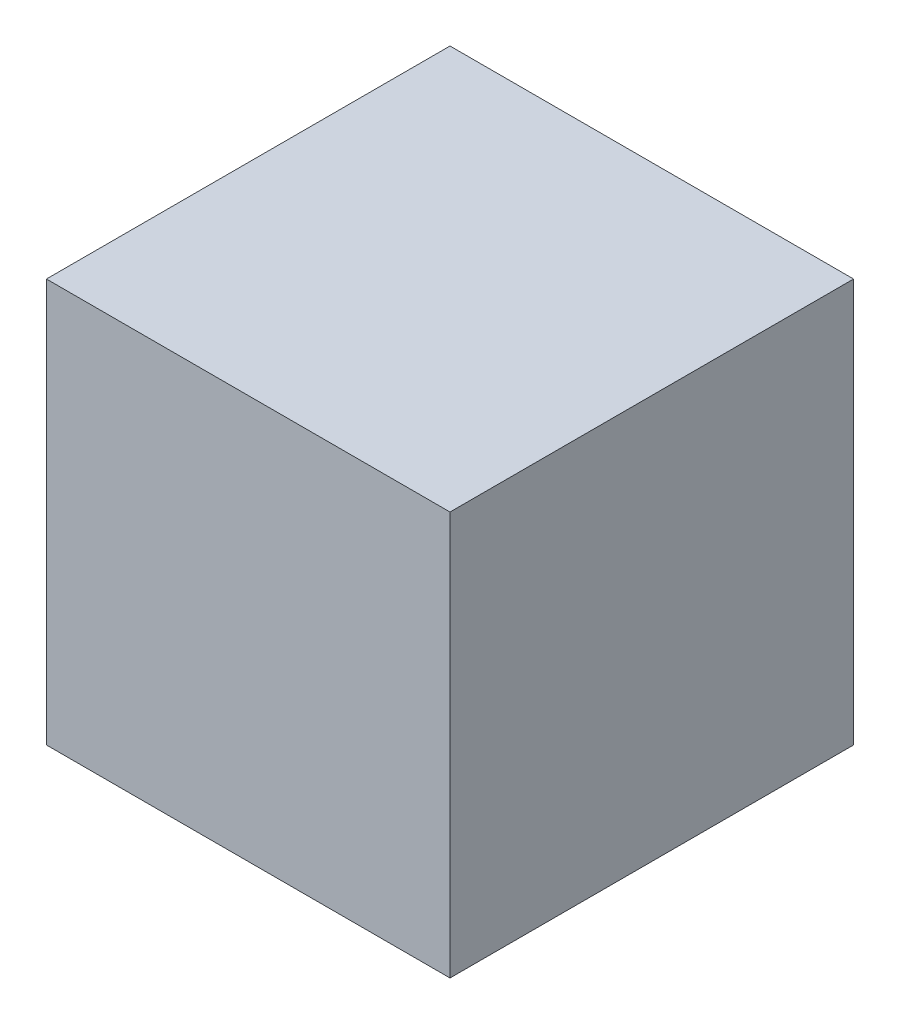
SolidWorks part; units mm, degrees
ref_plane "Front Plane" through (0, 0, 0) normal (0, 0, 1) x (1, 0, 0)
ref_plane "Top Plane" through (0, 0, 0) normal (0, 1, 0) x (1, 0, 0)
ref_plane "Right Plane" through (0, 0, 0) normal (1, 0, 0) x (0, 0, -1)
sketch "Sketch1" plane through (0, 0, 0) normal (0, 0, 1) x (1, 0, 0)
  line L1 (-20, 20) -> (20, 20)
  line L2 (-20, 20) -> (-20, -20)
  line L3 (-20, -20) -> (20, -20)
  line L4 (20, 20) -> (20, -20)
  line L5 (-20, 20) -> (20, -20) construction
  line L6 (-20, -20) -> (20, 20) construction
  point P0 (0, 0)
  dimension "D1" = 40
  dimension "D2" = 40
extrude "Boss-Extrude1" add sketch "Sketch1" along normal blind 40
sketch "Sketch2" plane through (0, 20, 0) normal (0, 0, 1) x (1, 0, 0)
  line L0 (0, -20) -> (0, 0) construction
  line L1 (20, 0) -> (-20, 0) construction
  line L2 (-20, -20) -> (20, -20) construction
  line L5 (20, -40) -> (20, 0) construction
  line L6 (-20, 0) -> (-20, -40) construction
  circle A0 centre (-14.08, -20) radius 1.59
  circle A1 centre (14.5, -20) radius 1.59
  point P7 (0, 0)
  point P15 (0, 0)
  point P17 (0, 0)
  dimension "D2" = 3.18
  dimension "D3" = 5.5
  dimension "D1" = 28.58
extrude "Cut-Extrude1" cut sketch "Sketch2" along normal blind 7 contours A0 | A1
